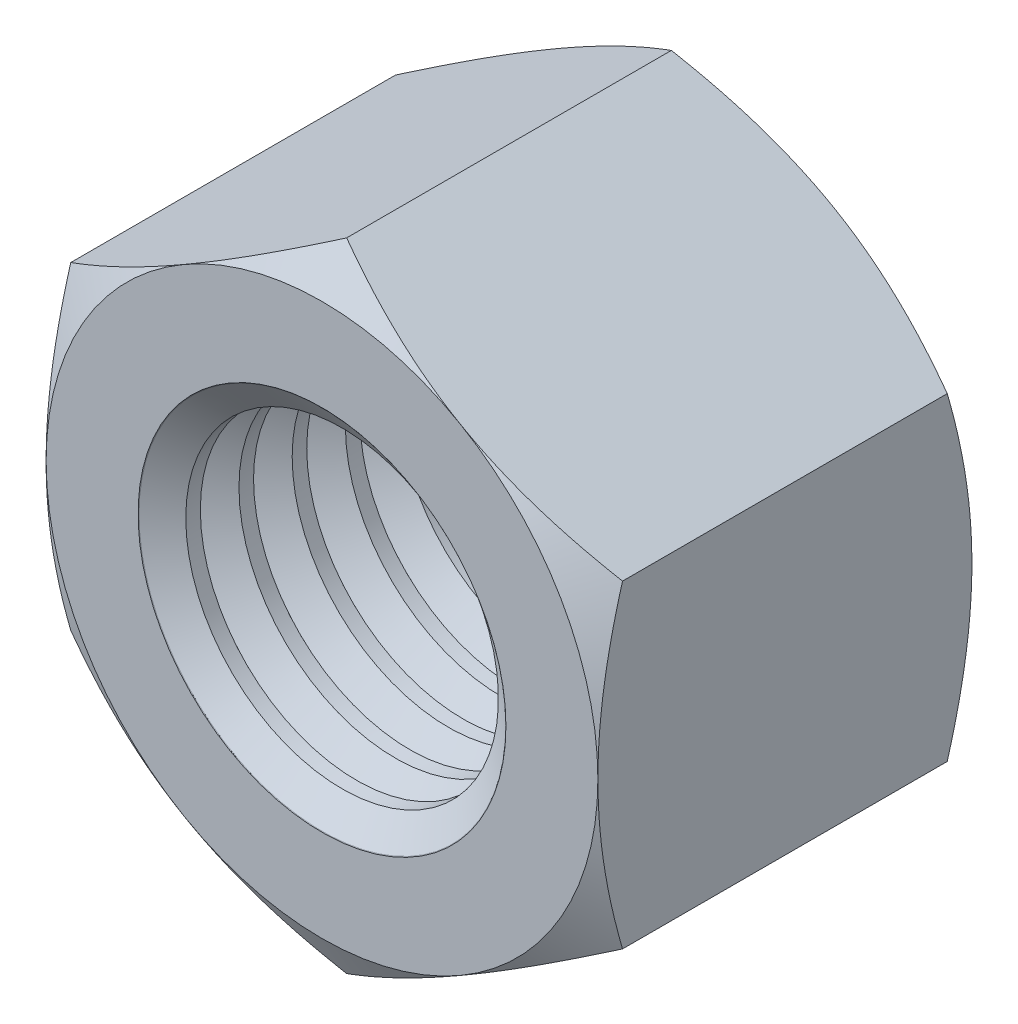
SolidWorks part; units mm, degrees
ref_plane "Plane1" through (0, 0, 0) normal (0, 0, 1) x (1, 0, 0)
ref_plane "Plane2" through (0, 0, 0) normal (0, 1, 0) x (1, 0, 0)
ref_plane "Plane3" through (0, 0, 0) normal (1, 0, 0) x (0, 0, -1)
revolve "EndChamfer" cut sketch "Sketch5"
sketch "Sketch5"
  line L0 (12.1746, 6) -> (11.4814, 5.01)
  line L1 (12.2254, 6) -> (12.1746, 6)
  line L2 (12.2254, 6) -> (12.2254, 5.01)
  line L3 (12.2254, 5.01) -> (11.4814, 5.01)
  line L6 (-0.0508, 6) -> (0, 6)
  line L7 (0, 6) -> (0.6932, 5.01)
  line L9 (0.6932, 5.01) -> (-0.0508, 5.01)
  line L10 (-0.0508, 5.01) -> (-0.0508, 6)
  line L11 (25.0375, 0) -> (38.388, 0) construction
  line L12 (12.2, 0) -> (0, 0) construction
extrude "BaseNut" add sketch "BaseNutSke" against normal blind 12.2
sketch "BaseNutSke" plane through (0, 0, 0) normal (0, 0, 1) x (1, 0, 0)
  line L6 (9, 5.1962) -> (9, -5.1962)
  line L7 (-9, 5.1962) -> (-9, -5.1962)
  line L8 (9, 5.1962) -> (0, 10.3923)
  line L9 (0, 10.3923) -> (-9, 5.1962)
  line L10 (-9, -5.1962) -> (0, -10.3923)
  line L11 (0, -10.3923) -> (9, -5.1962)
  circle A0 centre (0, 0) radius 5.1
  dimension "D4" = 9
  dimension "Tap_drill" = 10.2
  dimension "D1" = 120
  dimension "D2" = 9
  dimension "D3" = 9
  dimension "Width_flats" = 18
pattern_linear "ThdSchPat" count 7 spacing 1.7356 along (0, 0, -1)
revolve "ThreadSchematic" cut sketch "ThdSchSke" angle 360 about L6
sketch "ThdSchSke" plane through (0, 0, 0) normal (0, 1, 0) x (1, 0, 0)
  line L0 (-6, 0.0254) -> (-5.1, 0.6556)
  line L1 (-5.1, 0.6556) -> (-2.55, 0.6556)
  line L2 (-2.55, 0.6556) -> (-2.55, -0.6048)
  line L3 (-2.55, -0.6048) -> (-5.1, -0.6048)
  line L4 (-5.1, -0.6048) -> (-6, 0.0254)
  line L5 (-3.175, 1.75) -> (3.175, 1.75) construction
  line L6 (0, 1.75) -> (0, -2.9874) construction
  line L7 (0, 11.5444) -> (0, 0.6302) construction
  dimension "D1" = 0.0254
  dimension "VeeAngle" = 70
  dimension "SideAngle" = 55
  dimension "OverCut" = 5.1
  dimension "Tap_Drill" = 10.2
  dimension "Advance" = 1.75
  dimension "Thread_major" = 12
sketch "Sketch3" plane through (0, 0, 0) normal (1, 0, 0) x (0, 0, -1)
  line L0 (12.2, 9) -> (11.3962, 10.3923)
  line L1 (11.3962, 10.3923) -> (11.3962, 20.3923)
  line L2 (11.3962, 20.3923) -> (22.2, 20.3923)
  line L3 (22.2, 20.3923) -> (22.2, 9)
  line L4 (22.2, 9) -> (12.2, 9)
  line L5 (12.2, 5.1962) -> (12.2, 10.3923) construction
  line L6 (12.2, 10.3923) -> (0, 10.3923) construction
  line L7 (0, 0) -> (38.6776, 0) construction
  line L8 (12.2, 0) -> (0, 0) construction
  line L9 (6.1, 10.3923) -> (6.1, 44.222) construction
  line L10 (0.8038, 20.3923) -> (-10, 20.3923)
  line L11 (-10, 20.3923) -> (-10, 9)
  line L12 (-10, 9) -> (0, 9)
  line L13 (0, 9) -> (0.8038, 10.3923)
  line L14 (0.8038, 10.3923) -> (0.8038, 20.3923)
  line L16 (12.2, 10.3923) -> (0, 10.3923) construction
  dimension "D1" = 9
  dimension "D2" = 30
  dimension "D3" = 10
  dimension "D4" = 10
revolve "Double-Chamfer" cut sketch "Sketch3" angle 360 about L7
equation "\"D2@BaseNutSke\" = \"Width_flats@BaseNutSke\" / 2"
equation "\"D3@BaseNutSke\" = \"Width_flats@BaseNutSke\" / 2"
equation "\"D1@Sketch3\" = \"Width_flats@BaseNutSke\" /2"
equation "\"D4@BaseNutSke\" = \"D3@BaseNutSke\""
equation "\"Thread_major@ThdSchSke\" = \"Thread_major@ThreadCosmetic\""
equation "\"Tap_drill@ThdSchSke\" = \"Tap_drill@BaseNutSke\""
equation "\"Overcut@ThdSchSke\" = \"Tap_drill@ThdSchSke\" * 0.5"
equation "\"Num_threads@ThdSchPat\" = int(  ( \"Thickness@BaseNut\" - 0.0508 ) / \"Advance@ThdSchSke\" + 0.999 )  + 1"
equation "\"Advance@ThdSchPat\" = ( \"Thickness@BaseNut\" - 0.0508 ) /  (\"Num_threads@ThdSchPat\" - 1) 'relax it"
equation "' \"Num_threads@ThdSchPat\" = \"Num_threads@ThdSchPat\" - sgn( \"Num_threads@ThdSchPat\" - 1) '---chamfered tips only---"
equation "\"ThreadMajor@Sketch5\" = \"Thread_major@ThreadCosmetic\" * 0.5"
equation "\"ChamferDepth@Sketch5\" = (\"Thread_major@ThreadCosmetic\" - \"Tap_drill@BaseNutSke\") * 0.55"
equation "\"Offset1@Sketch5\" = \"Thickness@BaseNut\" + 0.0254"
equation "\"Offset2@Sketch5\" = \"Offset1@Sketch5\" + 0.0508"
